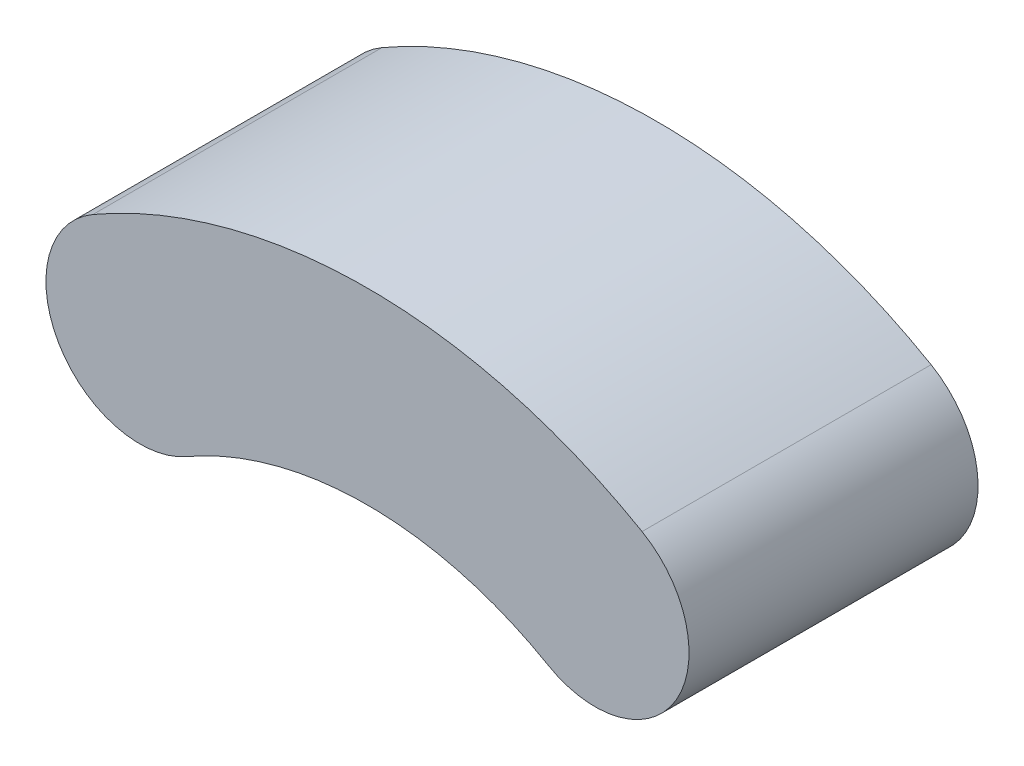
SolidWorks part; units mm, degrees
ref_plane "Plane1" through (0, 0, 0) normal (0, 0, 1) x (1, 0, 0)
ref_plane "Plane2" through (0, 0, 0) normal (0, 1, 0) x (1, 0, 0)
ref_plane "Plane3" through (0, 0, 0) normal (1, 0, 0) x (0, 0, -1)
sketch "Sketch1" plane through (0, 0, 0) normal (0, 0, 1) x (0.866, 0.5, 0)
  arc A0 (49, 9.9499) -> (33.1168, 37.4603) centre (0, 0) ccw
  arc A1 (49, -9.9499) -> (49, 9.9499) centre (50, 0) ccw
  arc A2 (15.8832, -47.4102) -> (33.1168, -37.4603) centre (25, -43.3013) ccw
  arc A3 (-33.1168, -37.4603) -> (-15.8832, -47.4102) centre (-25, -43.3013) ccw
  arc A4 (-49, 9.9499) -> (-49, -9.9499) centre (-50, 0) ccw
  arc A5 (-15.8832, 47.4102) -> (-33.1168, 37.4603) centre (-25, 43.3013) ccw
  arc A6 (33.1168, 37.4603) -> (15.8832, 47.4102) centre (25, 43.3013) ccw
  arc A7 (15.8832, 47.4102) -> (-15.8832, 47.4102) centre (0, 0) ccw
  arc A8 (-33.1168, 37.4603) -> (-49, 9.9499) centre (0, 0) ccw
  arc A9 (-49, -9.9499) -> (-33.1168, -37.4603) centre (0, 0) ccw
  arc A10 (-15.8832, -47.4102) -> (15.8832, -47.4102) centre (0, 0) ccw
  arc A11 (33.1168, -37.4603) -> (49, -9.9499) centre (0, 0) ccw
  arc A12 (21.6506, 12.5) -> (0, 25) centre (0, 0) ccw construction
  arc A13 (32.909, 19) -> (0, 38) centre (0, 0) ccw construction
  arc A14 (0, 38) -> (0, 25) centre (0, 31.5) ccw construction
  arc A15 (21.6506, 12.5) -> (32.909, 19) centre (27.2798, 15.75) ccw construction
  dimension "D1" = 100
  dimension "D4" = 10
  dimension "D5" = 30
  dimension "D6" = 25
  dimension "D8" = 13
  dimension "D7" = 60
extrude "Base-Extrude" add sketch "Sketch1" along normal blind 20
sketch "Sketch2" plane through (0, 0, 20) normal (0, 0, 1) x (1, 0, 0)
  arc A0 (-19, 32.909) -> (-12.5, 21.6506) centre (-15.75, 27.2798) ccw construction
  arc A1 (19, 32.909) -> (-19, 32.909) centre (0, 0) ccw construction
  arc A2 (12.5, 21.6506) -> (19, 32.909) centre (15.75, 27.2798) ccw construction
  arc A3 (12.5, 21.6506) -> (-12.5, 21.6506) centre (0, 0) ccw construction
  arc A4 (-19, 32.909) -> (-12.5, 21.6506) centre (-15.75, 27.2798) ccw
  arc A5 (19, 32.909) -> (-19, 32.909) centre (0, 0) ccw
  arc A6 (12.5, 21.6506) -> (19, 32.909) centre (15.75, 27.2798) ccw
  arc A7 (12.5, 21.6506) -> (-12.5, 21.6506) centre (0, 0) ccw
extrude "Cut-Extrude2" cut sketch "Sketch2" against normal through all flip side to cut
